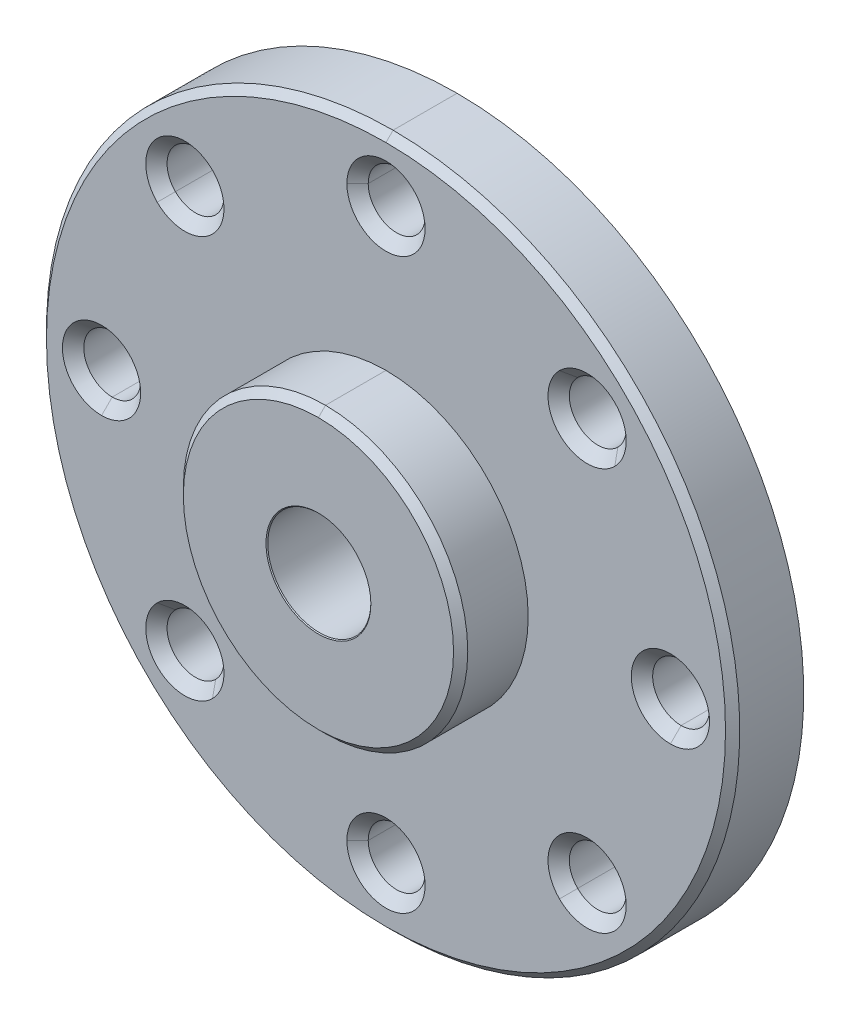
SolidWorks part; units mm, degrees
ref_plane "Front Plane" through (0, 0, 0) normal (0, 0, 1) x (1, 0, 0)
ref_plane "Top Plane" through (0, 0, 0) normal (0, 1, 0) x (1, 0, 0)
ref_plane "Right Plane" through (0, 0, 0) normal (1, 0, 0) x (0, 0, -1)
body saved out of another part "Stock-XM,H-430_axle-1"
sketch "Sketch1" plane through (0, 0, 20.9) normal (0, 0, 1) x (1, 0, 0)
  point P0 (0, 0)
hole_wizard "M2.5 Clearance Hole1" positions "Sketch1" profile "Sketch3" hole size "M2.5" standard "ANSI Metric"
sketch "Sketch3" plane through (0, 0, 20.9) normal (1, 0, 0) x (0, -1, 0)
  line L0 (0, 0) -> (0, 6.35)
  line L1 (0, 6.35) -> (1.45, 5.4788)
  line L2 (1.45, 5.4788) -> (1.45, 0.025)
  line L3 (1.45, 0.025) -> (1.475, 0)
  line L5 (1.475, 0) -> (0, 0)
  line L6 (-1.45, 0.025) -> (-1.475, 0) construction
  line L10 (0, 6.35) -> (-1.45, 5.4788) construction
  line L11 (0, -6.35) -> (0, 107.95) construction
  dimension "Hole Dia." = 2.9
  dimension "Hole Depth" = 6.35
  dimension "Near C'Sink Dia." = 2.95
  dimension "Near C'Sink Angle" = 90
  dimension "Drill Angle" = 118
